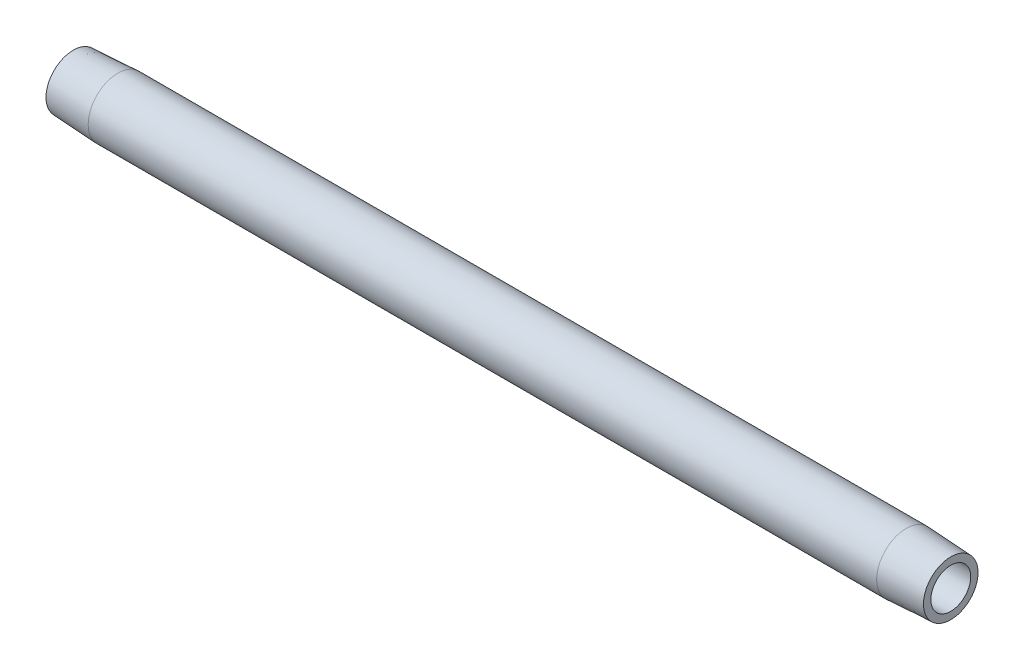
SolidWorks part; units mm, degrees
ref_plane "Front Plane" through (0, 0, 0) normal (0, 0, 1) x (1, 0, 0)
ref_plane "Top Plane" through (0, 0, 0) normal (0, 1, 0) x (1, 0, 0)
ref_plane "Right Plane" through (0, 0, 0) normal (1, 0, 0) x (0, 0, -1)
sketch "Sketch1" plane through (0, 0, 0) normal (0, 1, 0) x (1, 0, 0)
  line L6 (203.2, 4.6228) -> (0, 4.6228)
  line L7 (10.3124, 6.858) -> (0, 6.3175)
  line L8 (0, 6.3175) -> (0, 4.6228)
  line L9 (192.8876, 6.858) -> (10.3124, 6.858)
  line L10 (203.2, 6.3175) -> (192.8876, 6.858)
  line L11 (203.2, 4.6228) -> (203.2, 6.3175)
  line L12 (-6.376, 0) -> (49993.624, 0) construction
  dimension "D1" = 9.2456
  dimension "D2" = 13.716
  dimension "D3" = 3
  dimension "D4" = 3
  dimension "D5" = 203.2
  dimension "D6" = 10.3124
  dimension "D7" = 10.3124
revolve "Revolve1" add sketch "Sketch1" angle 360 about L12
